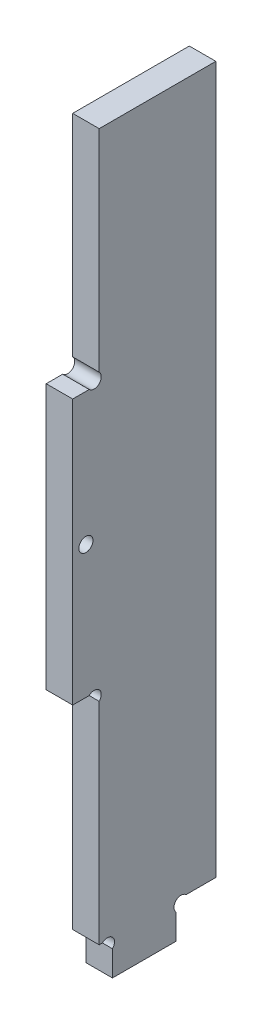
SolidWorks part; units mm, degrees
ref_plane "Plan de face" through (0, 0, 0) normal (0, 0, 1) x (1, 0, 0)
ref_plane "Plan de dessus" through (0, 0, 0) normal (0, 1, 0) x (1, 0, 0)
ref_plane "Plan de droite" through (0, 0, 0) normal (1, 0, 0) x (0, 0, -1)
sketch "Esquisse1" plane through (0, 0, 0) normal (1, 0, 0) x (0, 0, -1)
  line L0 (0, -29.3046) -> (0, 213.807) construction
  line L1 (-31.1146, 0) -> (70.4954, 0) construction
  line L2 (-31.1146, 168) -> (70.4954, 168) construction
  line L3 (32.4, -29.3046) -> (32.4, 213.807) construction
  line L4 (16.2, 203.6202) -> (16.2, 158.5445) construction
  line L5 (-3.4976, 8) -> (61.1207, 8) construction
  line L6 (6, 173.9983) -> (6, -7.2697) construction
  line L7 (23.4, 8) -> (39.4145, -8.0145) construction
  line L8 (23.4, 20.5001) -> (23.4, -29.3046) construction
  line L9 (6.7373, 8) -> (6, 8)
  line L10 (-31.1146, 88) -> (22.5923, 88) construction
  line L11 (3, 106.7216) -> (3, 86.8101) construction
  line L12 (-14.4342, 143) -> (18.9701, 143) construction
  line L13 (9, 5.7373) -> (9, 0)
  line L14 (18.9701, 118) -> (-21.7898, 118) construction
  line L15 (9, 0) -> (23.4, 0)
  line L16 (23.4, 0) -> (23.4, 5.7373)
  line L17 (25.6627, 8) -> (32.4, 8)
  line L18 (32.4, 8) -> (32.4, 168)
  line L19 (32.4, 168) -> (6, 168)
  line L23 (6, 118) -> (-11.9258, 135.9258) construction
  line L24 (6, 120.2627) -> (6, 168)
  line L25 (3.7373, 118) -> (0, 118)
  line L29 (0, 118) -> (0, 58)
  line L30 (0, 58) -> (3.7373, 58)
  line L31 (6, 55.7373) -> (6, 8)
  circle A0 centre (3, 88) radius 1.6
  arc A1 (3.7373, 118) -> (6, 120.2627) centre (4.8686, 119.1314) ccw
  arc A2 (25.6627, 8) -> (23.4, 5.7373) centre (24.5314, 6.8686) ccw
  arc A3 (6.7373, 8) -> (9, 5.7373) centre (7.8686, 6.8686) cw
  arc A6 (3.7373, 58) -> (6, 55.7373) centre (4.8686, 56.8686) cw
  dimension "D14" = 45
  dimension "D1" = 32.4
  dimension "D2" = 168
  dimension "D3" = 16.2
  dimension "D4" = 80
  dimension "D5" = 6
  dimension "D6" = 3
  dimension "D7" = 25
  dimension "D8" = 9
  dimension "D9" = 45
  dimension "D11" = 8
  dimension "D12" = 50
extrude "Boss.-Extru.1" add sketch "Esquisse1" along normal blind 6
